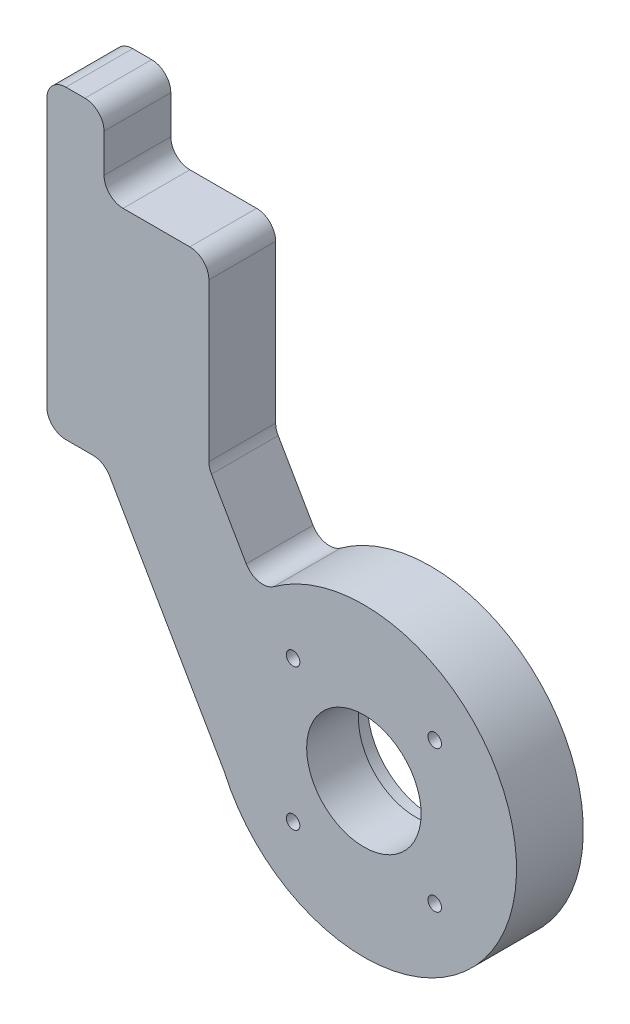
SolidWorks part; units mm, degrees
ref_plane "Front Plane" through (0, 0, 0) normal (0, 0, 1) x (1, 0, 0)
ref_plane "Top Plane" through (0, 0, 0) normal (0, 1, 0) x (1, 0, 0)
ref_plane "Right Plane" through (0, 0, 0) normal (1, 0, 0) x (0, 0, -1)
sketch "Sketch1" plane through (0, 0, 0) normal (0, 0, 1) x (1, 0, 0)
  line L0 (-37.2519, 51.7938) -> (-88.3587, 140.3134)
  line L1 (-103.139, 144.2737) -> (-117.3938, 136.0437)
  line L2 (-121.3542, 121.2634) -> (-48.3292, -5.2197)
  arc A0 (-48.3292, -5.2197) -> (-37.2519, 51.7938) centre (-1.8744, 15.3374) ccw
  arc A1 (-88.3587, 140.3134) -> (-103.139, 144.2737) centre (-97.729, 134.9034) ccw
  arc A2 (-117.3938, 136.0437) -> (-121.3542, 121.2634) centre (-111.9839, 126.6733) ccw
  circle A5 centre (-1.8744, 15.3374) radius 19.05
  dimension "D2" = 101.6
  dimension "D3" = 38.1
  dimension "D1" = 38.1
  dimension "D5" = 12.4096
  dimension "D6" = 146.05
extrude "Boss-Extrude1" add sketch "Sketch1" along normal blind 22.225
sketch "Sketch4" plane through (0, 0, 22.225) normal (0, 0, 1) x (1, 0, 0)
  line L0 (-88.3587, 140.3134) -> (-88.3587, 64.1134)
  line L2 (-121.3542, 121.2634) -> (-48.3292, -5.2197) construction
  line L3 (-103.139, 144.2737) -> (-117.3938, 136.0437) construction
  line L4 (-121.3542, 121.2634) -> (-88.3587, 64.1134)
  line L5 (-103.139, 144.2737) -> (-117.3938, 136.0437)
  arc A0 (-117.3938, 136.0437) -> (-121.3542, 121.2634) centre (-111.9839, 126.6733) ccw construction
  arc A1 (-88.3587, 140.3134) -> (-103.139, 144.2737) centre (-97.729, 134.9034) ccw construction
  arc A2 (-117.3938, 136.0437) -> (-121.3542, 121.2634) centre (-111.9839, 126.6733) ccw
  arc A3 (-88.3587, 140.3134) -> (-103.139, 144.2737) centre (-97.729, 134.9034) ccw
extrude "Cut-Extrude1" cut sketch "Sketch4" against normal blind 38.1
sketch "Sketch5" plane through (-88.3587, 0, 0) normal (-1, 0, 0) x (0, 0, 1)
  line L0 (0, 64.1134) -> (22.225, 64.1134)
  line L1 (0, 64.1134) -> (0, 165.7134)
  line L2 (0, 165.7134) -> (22.225, 165.7134)
  line L3 (22.225, 64.1134) -> (22.225, 165.7134)
  line L6 (0, 64.1134) -> (22.225, 64.1134) construction
  line L7 (22.225, 64.1134) -> (22.225, 140.3134) construction
  dimension "D1" = 101.6
  dimension "D2" = 22.225
extrude "Boss-Extrude2" add sketch "Sketch5" along normal blind 19.05
sketch "Sketch6" plane through (-107.4087, 0, 0) normal (-1, 0, 0) x (0, 0, 1)
  line L0 (22.225, 165.7134) -> (0, 165.7134) construction
  line L1 (22.225, 64.1134) -> (22.225, 165.7134) construction
  circle A0 centre (11.1125, 153.0134) radius 4.6
  circle A1 centre (11.1125, 76.8134) radius 4.6
  dimension "D4" = 9.2
  dimension "D5" = 9.2
  dimension "D1" = 76.2
  dimension "D2" = 12.7
  dimension "D3" = 11.1125
extrude "Cut-Extrude2" cut sketch "Sketch6" against normal blind 12.7
sketch "Sketch9" plane through (0, 0, 0) normal (0, 0, -1) x (-1, 0, 0)
  line L0 (88.3587, 140.3134) -> (53.4638, 140.3134)
  line L1 (53.4638, 140.3134) -> (53.4638, 79.8738)
  line L2 (37.2519, 51.7938) -> (88.3587, 140.3134) construction
  line L3 (53.4638, 79.8738) -> (88.3587, 140.3134)
extrude "Boss-Extrude3" add sketch "Sketch9" against normal blind 22.225
sketch "Sketch10" plane through (0, 0, 22.225) normal (0, 0, 1) x (1, 0, 0)
  line L1 (-25.4444, 38.9074) -> (21.6956, 38.9074) construction
  line L2 (-25.4444, 38.9074) -> (-25.4444, -8.2326) construction
  line L3 (-25.4444, -8.2326) -> (21.6956, -8.2326) construction
  line L4 (21.6956, 38.9074) -> (21.6956, -8.2326) construction
  line L5 (-25.4444, 38.9074) -> (21.6956, -8.2326) construction
  line L6 (-25.4444, -8.2326) -> (21.6956, 38.9074) construction
  circle A0 centre (-25.4444, 38.9074) radius 2.25
  circle A1 centre (21.6956, 38.9074) radius 2.25
  circle A2 centre (21.6956, -8.2326) radius 2.25
  circle A3 centre (-25.4444, -8.2326) radius 2.25
  point P0 (-1.8744, 15.3374)
  dimension "D3" = 4.5
  dimension "D4" = 4.5
  dimension "D5" = 4.5
  dimension "D6" = 4.5
  dimension "D1" = 47.14
  dimension "D2" = 47.14
extrude "Cut-Extrude3" cut sketch "Sketch10" against normal blind 51.054
fillet "Fillet1" radius 6.35 9 edges at (-88.3587, 64.1134, 11.1125) (-107.4087, 64.1134, 11.1125) (-37.2519, 51.7938, 11.1125) (-53.4638, 79.8738, 11.1125) (-53.4638, 140.3134, 11.1125) (-88.3587, 140.3134, 11.1125) (-88.3587, 165.7134, 11.1125) (-48.3292, -5.2197, 11.1125) (-107.4087, 165.7134, 11.1125)
sketch "Sketch11" plane through (0, 0, 0) normal (0, 0, -1) x (-1, 0, 0)
  circle A0 centre (1.8744, 15.3374) radius 21
  dimension "D1" = 42
extrude "Cut-Extrude4" cut sketch "Sketch11" against normal blind 5
